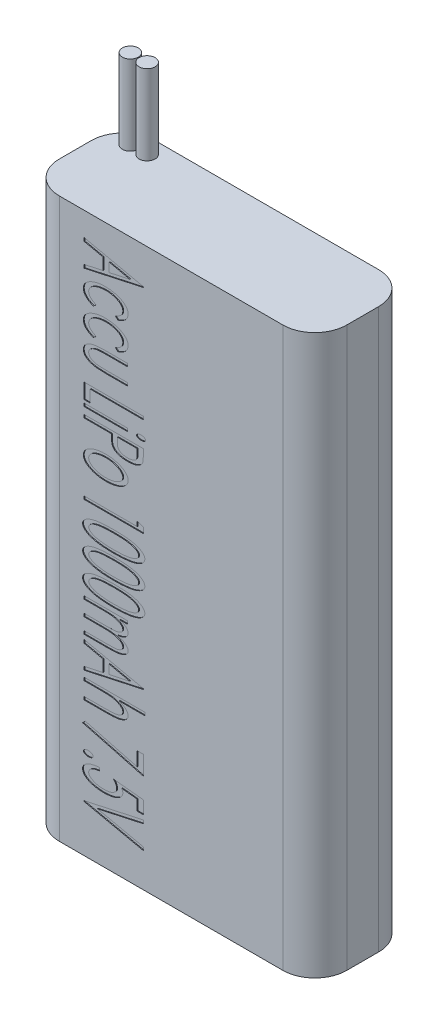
SolidWorks part; units mm, degrees
ref_plane "Plan de face" through (0, 0, 0) normal (0, 0, 1) x (1, 0, 0)
ref_plane "Plan de dessus" through (0, 0, 0) normal (0, 1, 0) x (1, 0, 0)
ref_plane "Plan de droite" through (0, 0, 0) normal (1, 0, 0) x (0, 0, -1)
sketch "Esquisse1" plane through (0, 0, 0) normal (0, 1, 0) x (1, 0, 0)
  line L1 (-14, 0) -> (14, 0)
  line L2 (-18, -4) -> (-18, -8)
  line L3 (-14, -12) -> (14, -12)
  line L4 (18, -4) -> (18, -8)
  arc A0 (-14, 0) -> (-18, -4) centre (-14, -4) ccw
  arc A1 (14, -12) -> (18, -8) centre (14, -8) ccw
  arc A2 (14, 0) -> (18, -4) centre (14, -4) cw
  arc A3 (-18, -8) -> (-14, -12) centre (-14, -8) ccw
  point P6 (-18, 0)
  point P11 (18, 0)
  point P14 (-18, -12)
  dimension "D5" = 4
  dimension "D1" = 12
  dimension "D3" = 36
extrude "Extrusion1" add sketch "Esquisse1" along normal blind 70
sketch "Esquisse2" plane through (0, 0, 12) normal (0, 0, 1) x (1, 0, 0)
  line L0 (-10.8876, 67.2261) -> (-10.8876, 0) construction
  line L2 (-14, 0) -> (14, 0) construction
  text T0 "Accu LiPo 1000mAh 7.5V" font "Century Gothic" height in points 28
extrude "Enlèv. mat.-Extru.1" cut sketch "Esquisse2" against normal blind 0.1
sketch "Esquisse3" plane through (0, 70, 0) normal (0, 1, 0) x (-1, 0, 0)
  line L0 (18, 4) -> (18, 8) construction
  line L1 (-14, 0) -> (14, 0) construction
  circle A0 centre (13, 2) radius 1
  circle A1 centre (15.1, 2) radius 1
  dimension "D1" = 2
  dimension "D2" = 2.1
  dimension "D3" = 5
  dimension "D4" = 2
extrude "Extrusion2" add sketch "Esquisse3" along normal blind 10
